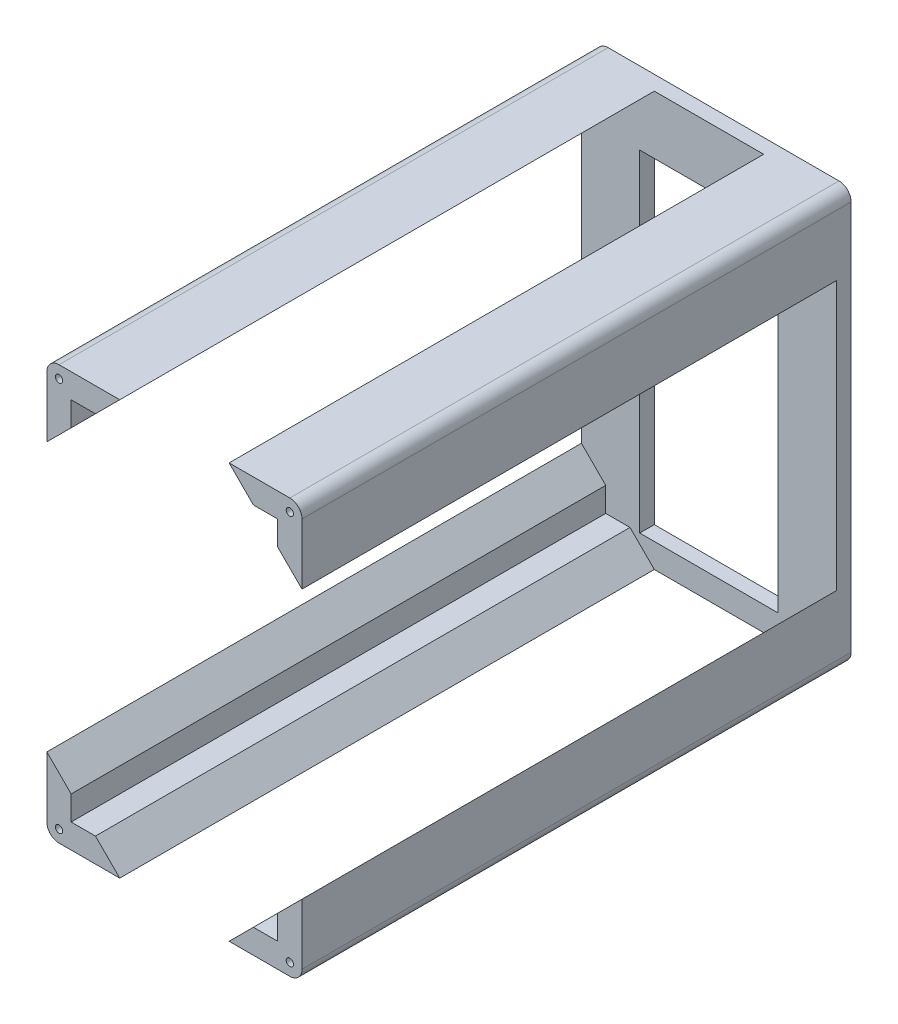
SolidWorks part; units mm, degrees
ref_plane "Front Plane" through (0, 0, 0) normal (0, 0, 1) x (1, 0, 0)
ref_plane "Top Plane" through (0, 0, 0) normal (0, 1, 0) x (1, 0, 0)
ref_plane "Right Plane" through (0, 0, 0) normal (1, 0, 0) x (0, 0, -1)
sketch "Croquis7" plane through (0, 0, 0) normal (0, 0, 1) x (1, 0, 0)
  line L1 (-515.3288, -99.5) -> (-410.3288, -99.5)
  line L2 (-515.3288, -99.5) -> (-515.3288, 71)
  line L3 (-515.3288, 71) -> (-410.3288, 71)
  line L4 (-410.3288, -99.5) -> (-410.3288, 71)
  line L5 (-515.3288, -99.5) -> (-410.3288, 71) construction
  line L6 (-515.3288, 71) -> (-410.3288, -99.5) construction
  point P0 (-462.8288, -14.25)
  dimension "D1" = 170.5
  dimension "D2" = 105
extrude "Saliente-Extruir7" add sketch "Croquis7" along normal blind 6 contours L3 L4 L1 L2
sketch "Croquis8" plane through (0, 0, 6) normal (0, 0, 1) x (1, 0, 0)
  line L0 (-515.3288, 71) -> (-485.3288, 71)
  line L1 (-515.3288, 71) -> (-410.3288, 71) construction
  line L2 (-485.3288, 71) -> (-515.3288, 41)
  line L3 (-515.3288, -99.5) -> (-515.3288, 71) construction
  line L4 (-515.3288, 41) -> (-515.3288, 71)
  line L5 (-410.3288, 71) -> (-410.3288, 41)
  line L6 (-440.3288, 71) -> (-410.3288, 71)
  line L7 (-410.3288, 41) -> (-440.3288, 71)
  line L8 (-485.3288, -99.5) -> (-515.3288, -99.5)
  line L9 (-515.3288, -69.5) -> (-485.3288, -99.5)
  line L10 (-515.3288, -99.5) -> (-515.3288, -69.5)
  line L11 (-410.3288, -69.5) -> (-410.3288, -99.5)
  line L12 (-440.3288, -99.5) -> (-410.3288, -69.5)
  line L13 (-410.3288, -99.5) -> (-440.3288, -99.5)
  line L14 (-410.3288, -99.5) -> (-410.3288, 71) construction
  line L15 (-515.3288, -99.5) -> (-410.3288, -99.5) construction
  dimension "D1" = 30
extrude "Saliente-Extruir8" add sketch "Croquis8" along normal blind 220
sketch "Croquis9" plane through (0, 0, 0) normal (0, 0, -1) x (-1, 0, 0)
  line L0 (410.3288, -99.5) -> (410.3288, 71) construction
  line L1 (434.3288, -89.5) -> (491.3288, -89.5)
  line L2 (434.3288, -89.5) -> (434.3288, 47)
  line L3 (434.3288, 47) -> (491.3288, 47)
  line L4 (491.3288, -89.5) -> (491.3288, 47)
  line L5 (434.3288, -89.5) -> (491.3288, 47) construction
  line L6 (434.3288, 47) -> (491.3288, -89.5) construction
  line L8 (515.3288, 71) -> (410.3288, 71) construction
  line L9 (515.3288, -99.5) -> (515.3288, 71) construction
  line L10 (515.3288, -99.5) -> (410.3288, -99.5) construction
  point P0 (462.8288, -21.25)
  dimension "D3" = 24
  dimension "D1" = 24
  dimension "D2" = 10
  dimension "D5" = 24
extrude "Cortar-Extruir1" cut sketch "Croquis9" along direction (0, 0, -1) on the side against the normal up to surface (6 mm away)
sketch "Croquis13" plane through (0, 0, 226) normal (0, 0, 1) x (1, 0, 0)
  line L5 (-505.3288, -89.5) -> (-420.3288, -89.5)
  line L6 (-505.3288, -89.5) -> (-505.3288, 61)
  line L12 (-505.3288, 61) -> (-420.3288, 61)
  line L13 (-420.3288, -89.5) -> (-420.3288, 61)
  line L14 (-505.3288, -89.5) -> (-420.3288, 61) construction
  line L15 (-505.3288, 61) -> (-420.3288, -89.5) construction
  dimension "D1" = 85
  dimension "D2" = 150.5
extrude "Cortar-Extruir3" cut sketch "Croquis13" along direction (0, 0, -1) on the side against the normal up to surface (220 mm away) contours L12 L13 L5 L6
fillet "Redondeo4" radius 5 2 edges at (-410.3288, -99.5, 113) (-515.3288, -99.5, 113)
fillet "Redondeo5" radius 5 1 edges at (-515.3288, 71, 113)
fillet "Redondeo6" radius 5 1 edges at (-410.3288, 71, 113)
hole_wizard "Ø3.0mm Dowel Hole1" positions "Croquis3D1" profile "Croquis14" hole size "Ø3.0" standard "ISO"
sketch3d "Croquis3D1"
  line L0 (-515.3288, 66, 226) -> (-515.3288, 41, 226) construction
  line L1 (-485.3288, 71, 226) -> (-510.3288, 71, 226) construction
  line L2 (-410.3288, 41, 226) -> (-410.3288, 66, 226) construction
  line L3 (-440.3288, -99.5, 226) -> (-415.3288, -99.5, 226) construction
  line L4 (-410.3288, -94.5, 226) -> (-410.3288, -69.5, 226) construction
  line L5 (-510.3288, -99.5, 226) -> (-485.3288, -99.5, 226) construction
  line L6 (-515.3288, -69.5, 226) -> (-515.3288, -94.5, 226) construction
  point P0 (-510.3288, 66, 226)
  point P2 (-415.3288, 66, 226)
  point P4 (-415.3288, -94.5, 226)
  point P6 (-510.3288, -94.5, 226)
  dimension "D1" = 5
  dimension "D2" = 5
  dimension "D3" = 5
  dimension "D4" = 5
  dimension "D5" = 5
  dimension "D6" = 5
  dimension "D7" = 5
  dimension "D8" = 5
sketch "Croquis14" plane through (-510.3288, 66, 226) normal (1, 0, 0) x (0, -1, 0)
  line L0 (0, 0) -> (0, 5)
  line L1 (0, 5) -> (1.5, 5)
  line L2 (1.5, 5) -> (1.5, 0)
  line L5 (1.5, 0) -> (0, 0)
  line L10 (0, 5) -> (-1.5, 5) construction
  line L11 (0, -6.35) -> (0, 107.95) construction
  dimension "Hole Dia." = 3
  dimension "Hole Depth" = 5
  dimension "Drill Angle" = 180
